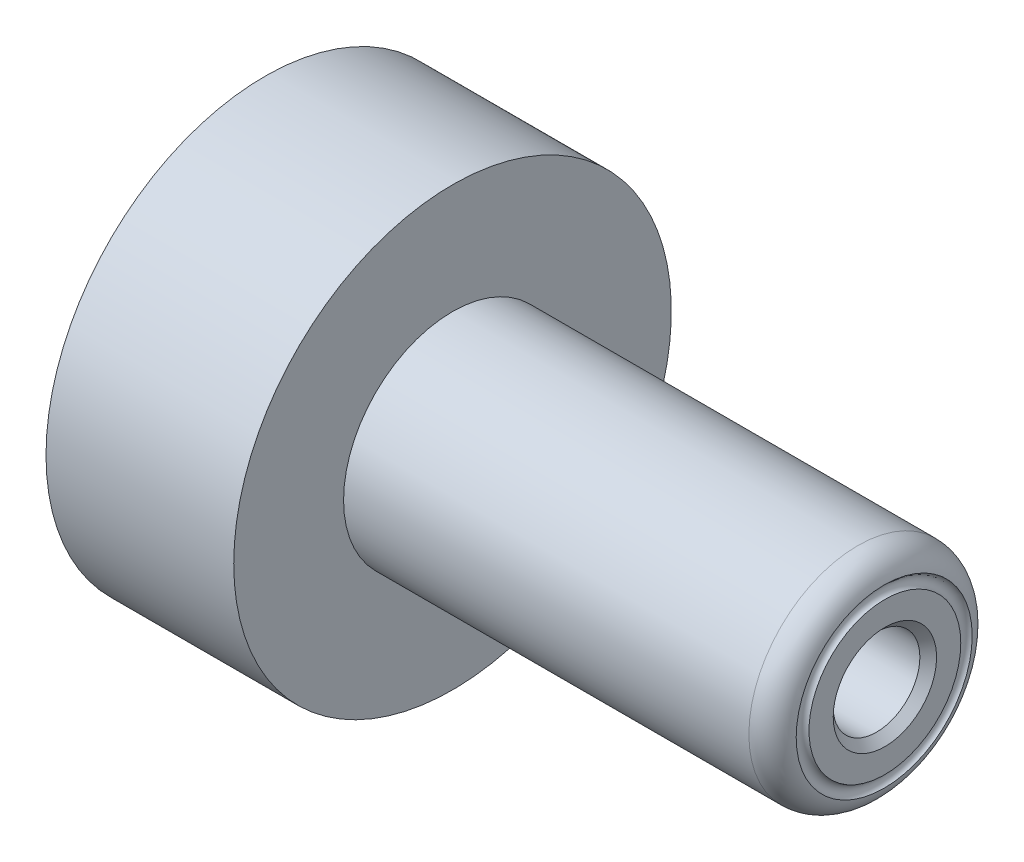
SolidWorks part; units mm, degrees
ref_plane "Front Plane" through (0, 0, 0) normal (0, 0, 1) x (1, 0, 0)
ref_plane "Top Plane" through (0, 0, 0) normal (0, 1, 0) x (1, 0, 0)
ref_plane "Right Plane" through (0, 0, 0) normal (1, 0, 0) x (0, 0, -1)
sketch "Sketch1" plane through (0, 0, 0) normal (0, 0, 1) x (1, 0, 0)
  line L0 (0, 0) -> (102.3864, 0) construction
  line L1 (0, 3.9751) -> (0, 12.7)
  line L2 (0, 12.7) -> (10.8966, 12.7)
  line L3 (10.8966, 12.7) -> (10.8966, 6.3246)
  line L4 (10.8966, 6.3246) -> (34.4218, 6.3246)
  line L5 (35.9918, 4.7546) -> (35.9918, 0)
  line L6 (35.9918, 0) -> (21.8948, 0)
  line L7 (0, 3.9751) -> (21.8948, 3.9751)
  line L8 (21.8948, 3.9751) -> (21.8948, 0)
  arc A0 (35.9918, 4.7546) -> (34.4218, 6.3246) centre (34.4218, 4.7546) ccw
  dimension "D5" = 1.57
  dimension "D1" = 10.8966
  dimension "D2" = 25.4
  dimension "D3" = 21.8948
  dimension "D4" = 7.9502
  dimension "D6" = 35.9918
  dimension "D7" = 12.6492
revolve "Revolve1" add sketch "Sketch1" angle 360 about L0
sketch "Sketch2" plane through (0, 0, 0) normal (-1, 0, 0) x (0, 0, 1)
  line L0 (0, 0) -> (0, 9.7644) construction
  circle A0 centre (-7.1374, 0) radius 1.6129
  circle A1 centre (7.1374, 0) radius 1.6129
  dimension "D2" = 3.2258
  dimension "D1" = 14.2748
extrude "Cut-Extrude1" cut sketch "Sketch2" against normal blind 6.35
sketch "Sketch3" plane through (35.9918, 0, 0) normal (1, 0, 0) x (0, 0, -1)
  circle A0 centre (0, 0) radius 2.515
  dimension "D1" = 5.03
extrude "Cut-Extrude2" cut sketch "Sketch3" against normal through all
chamfer "Chamfer1" distance 0.485 angle 45 1 edges at (35.9918, 0, -2.515)
sketch "Sketch4" plane through (0, 0, 0) normal (0, 0, 1) x (1, 0, 0)
  line L0 (0, 0) -> (38.1985, 0) construction
  line L1 (0, 12.7) -> (0, -12.7) construction
  circle A0 centre (36.117, 4.765) radius 0.381
  dimension "D2" = 4.765
  dimension "D3" = 0.381
  dimension "D1" = 36.117
revolve "Cut-Revolve1" cut sketch "Sketch4" angle 360 about L0
